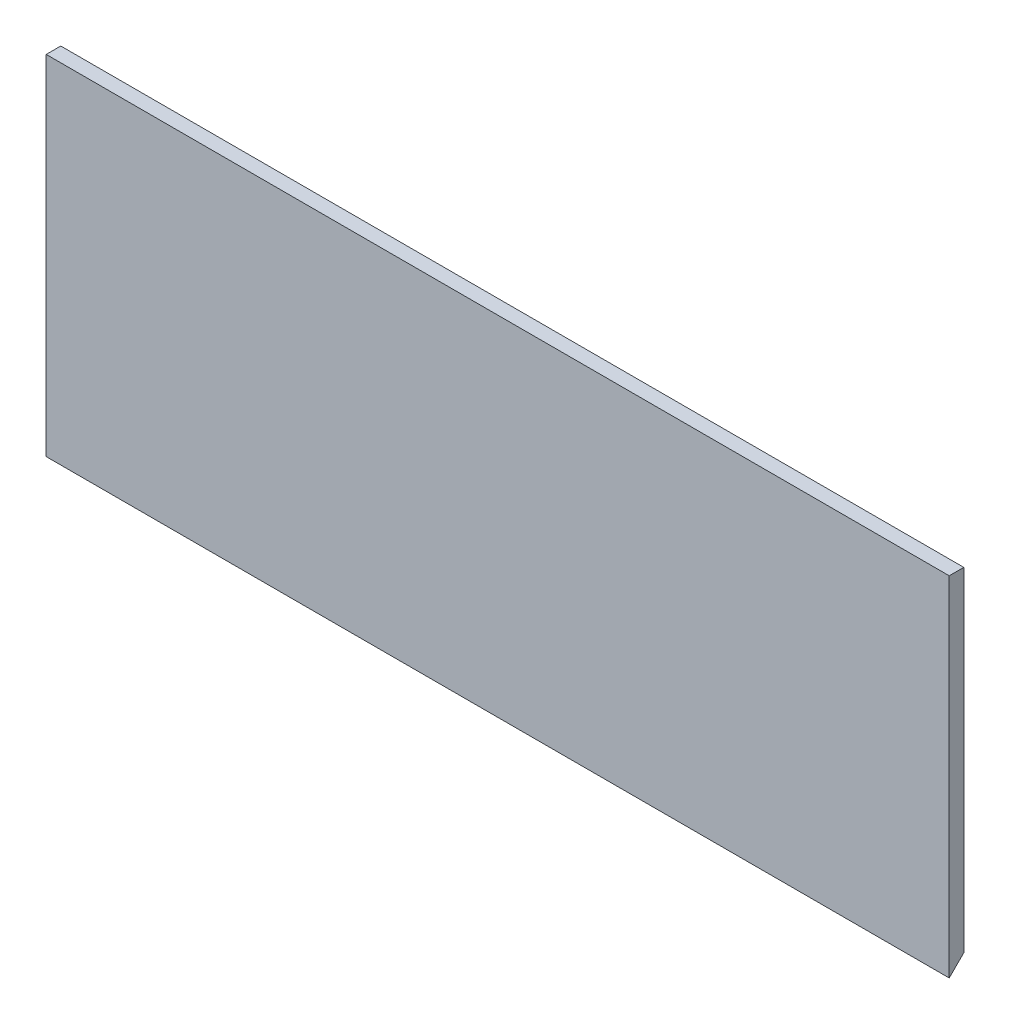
SolidWorks part; units mm, degrees
ref_plane "Front Plane" through (0, 0, 0) normal (0, 0, 1) x (1, 0, 0)
ref_plane "Top Plane" through (0, 0, 0) normal (0, 1, 0) x (1, 0, 0)
ref_plane "Right Plane" through (0, 0, 0) normal (1, 0, 0) x (0, 0, -1)
sketch "Sketch1" plane through (0, 0, 0) normal (0, 0, 1) x (1, 0, 0)
  line L1 (-590.55, -227.8062) -> (590.55, -227.8062)
  line L2 (-590.55, -227.8062) -> (-590.55, 227.8062)
  line L3 (-590.55, 227.8062) -> (590.55, 227.8062)
  line L4 (590.55, -227.8062) -> (590.55, 227.8062)
  line L5 (-590.55, -227.8062) -> (590.55, 227.8062) construction
  line L6 (-590.55, 227.8062) -> (590.55, -227.8062) construction
  point P0 (0, 0)
  dimension "D1" = 455.6125
  dimension "D2" = 1181.1
extrude "Extrude1" add sketch "Sketch1" along normal mid plane 19.05
sketch "Sketch2" plane through (590.55, 0, 0) normal (1, 0, 0) x (0, 0, -1)
  line L0 (-9.525, -227.8062) -> (9.525, -208.7562)
  line L4 (9.525, -227.8062) -> (9.525, 227.8062)
  line L5 (9.525, 227.8062) -> (-9.525, 227.8062)
  line L6 (-9.525, 227.8062) -> (-9.525, -227.8062)
  line L7 (-9.525, -227.8062) -> (9.525, -227.8062)
  line L8 (9.525, -227.8062) -> (9.525, 227.8062)
  line L9 (9.525, 227.8062) -> (-9.525, 227.8062)
  line L10 (-9.525, 227.8062) -> (-9.525, -227.8062)
  line L11 (-9.525, -227.8062) -> (9.525, -227.8062)
  dimension "D2" = 45
  dimension "D1" = 0
extrude "Extrude2" cut sketch "Sketch2" against normal through all contours L0 M8 M5
